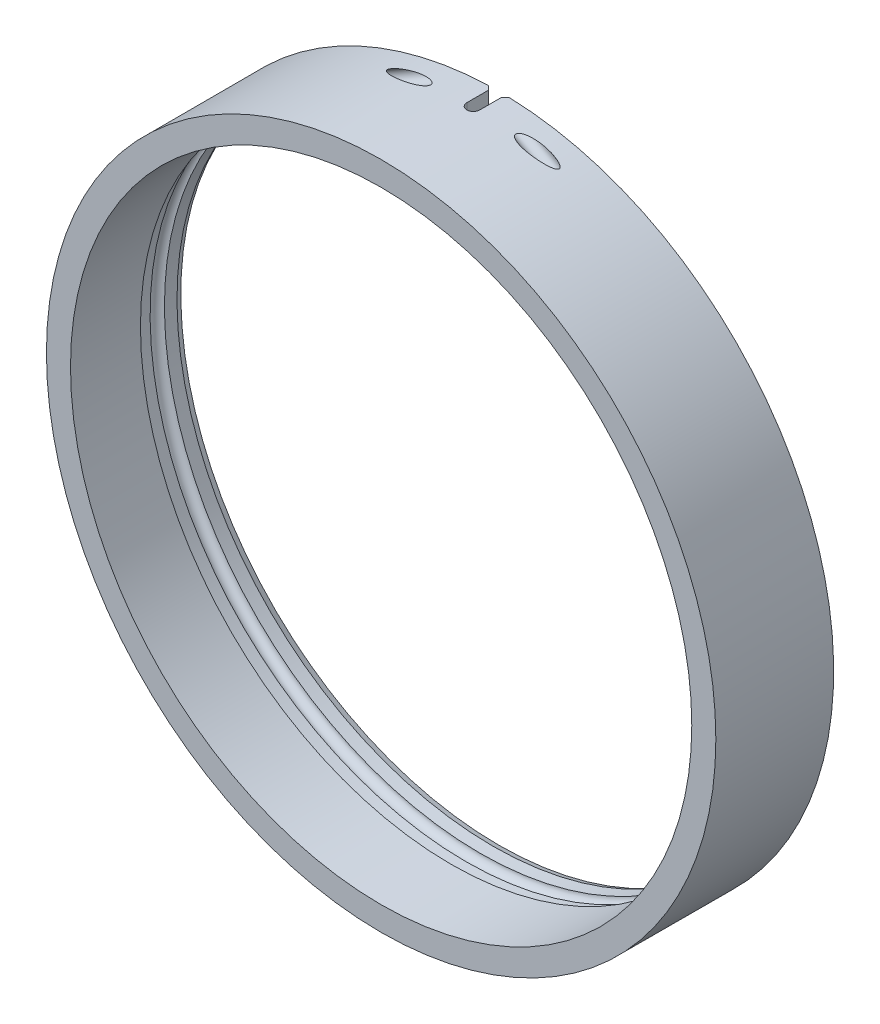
SolidWorks part; units mm, degrees
ref_plane "Front Plane" through (0, 0, 0) normal (0, 0, 1) x (1, 0, 0)
ref_plane "Top Plane" through (0, 0, 0) normal (0, 1, 0) x (1, 0, 0)
ref_plane "Right Plane" through (0, 0, 0) normal (1, 0, 0) x (0, 0, -1)
imported_body "Imported1"
ref_plane "Plane1" through (0, 0, -21.7138) normal (0, 0, -1) x (-1, 0, 0)
sketch "Sketch2" plane through (0, 0, -21.7138) normal (0, 0, -1) x (-1, 0, 0)
  circle A0 centre (0, 0) radius 148.5161
extrude "Cut-Extrude1" cut sketch "Sketch2" against normal through all
